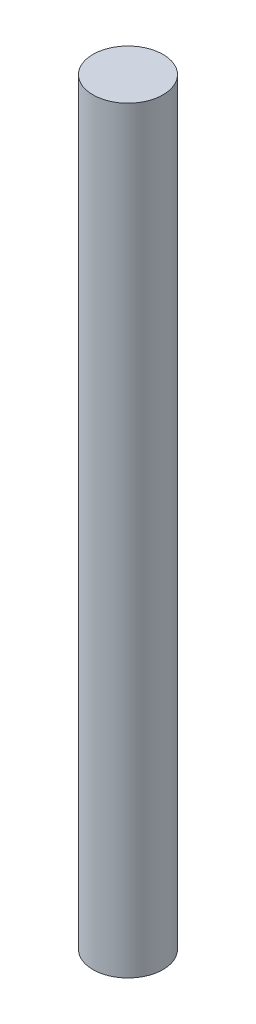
SolidWorks part; units mm, degrees
ref_plane "Front Plane" through (0, 0, 0) normal (0, 0, 1) x (1, 0, 0)
ref_plane "Top Plane" through (0, 0, 0) normal (0, 1, 0) x (1, 0, 0)
ref_plane "Right Plane" through (0, 0, 0) normal (1, 0, 0) x (0, 0, -1)
sketch "Sketch1" plane through (0, 0, 0) normal (0, 1, 0) x (1, 0, 0)
  circle A0 centre (0, 0) radius 5.5562
  dimension "D1" = 11.1125
extrude "Boss-Extrude1" add sketch "Sketch1" along normal blind 120.142
